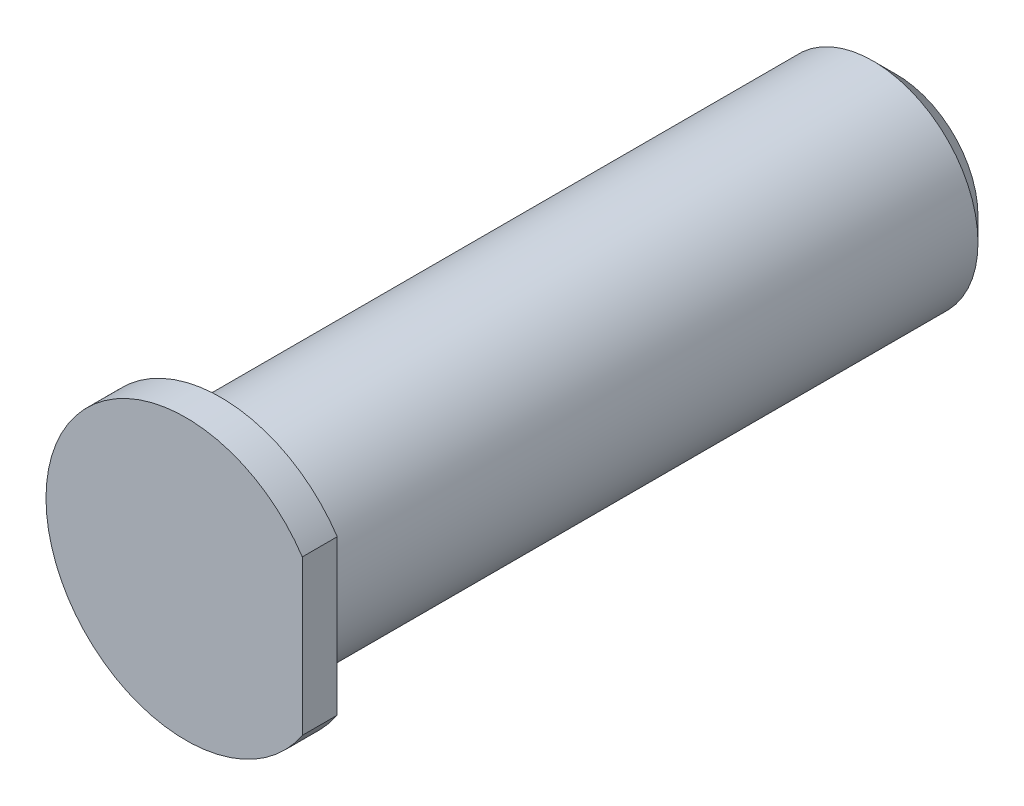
SolidWorks part; units mm, degrees
ref_plane "Plan1" through (0, 0, 0) normal (0, 0, 1) x (1, 0, 0)
ref_plane "Plan2" through (0, 0, 0) normal (0, 1, 0) x (1, 0, 0)
ref_plane "Plan3" through (0, 0, 0) normal (1, 0, 0) x (0, 0, -1)
sketch "Esquisse_cylindre" plane through (0, 0, 0) normal (0, 0, 1) x (1, 0, 0)
  circle A0 centre (0, 0) radius 4.5
  dimension "D1" = 9
extrude "Cylindre" add sketch "Esquisse_cylindre" against normal blind 29
sketch "Esquisse_épaulement" plane through (0, 0, 0) normal (0, 0, 1) x (1, 0, 0)
  line L0 (5, 3.3166) -> (5, -3.3166)
  arc A0 (5, 3.3166) -> (5, -3.3166) centre (0, 0) ccw
  dimension "D1" = 12
  dimension "D2" = 5
extrude "Epaulement" add sketch "Esquisse_épaulement" along normal blind 1.5
sketch "Esquisse_trou" plane through (0, 0, -29) normal (0, 0, -1) x (-1, 0, 0)
  circle A0 centre (0, 0) radius 2
  dimension "D1" = 4
extrude "Trou" cut sketch "Esquisse_trou" against normal blind 3.5
chamfer "Chanfrein1" distance 1 angle 45 1 edges at (4.5, 0, -29)
